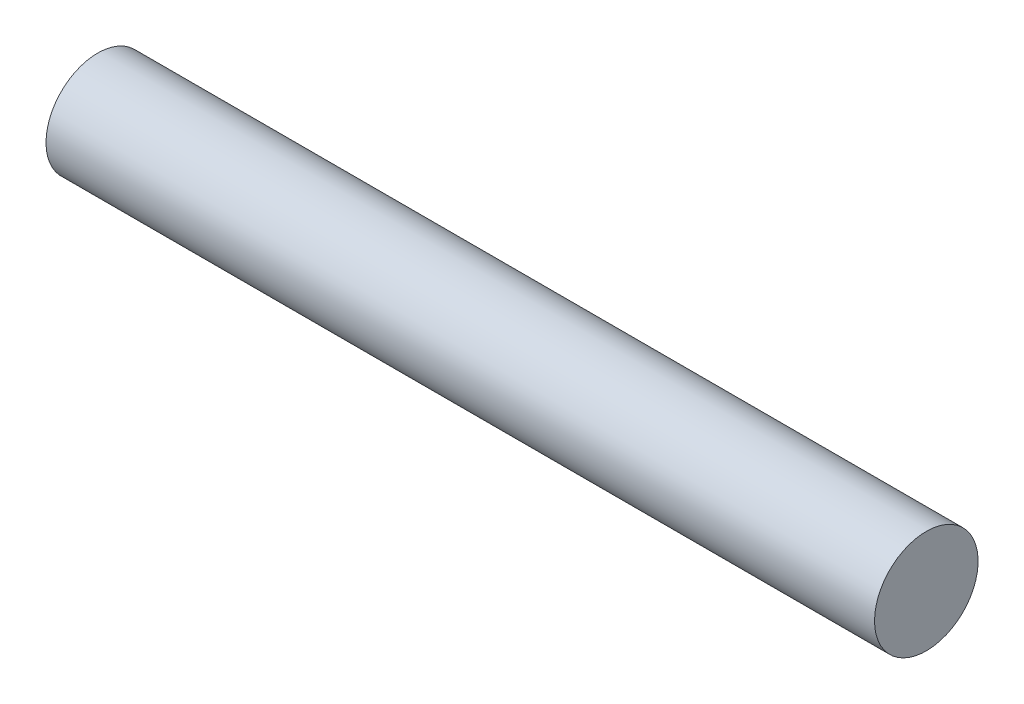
SolidWorks part; units mm, degrees
ref_plane "Front Plane" through (0, 0, 0) normal (0, 0, 1) x (1, 0, 0)
ref_plane "Top Plane" through (0, 0, 0) normal (0, 1, 0) x (1, 0, 0)
ref_plane "Right Plane" through (0, 0, 0) normal (1, 0, 0) x (0, 0, -1)
other "Configuration Table"
sketch "BodySke" plane through (0, 0, 0) normal (0, 0, 1) x (1, 0, 0)
  line L0 (0, 0) -> (93.7991, 0) construction
  line L1 (2, 5) -> (2, 0) construction
  line L2 (0, 0) -> (80, 0)
  line L3 (0, 0) -> (0, 5)
  line L4 (0, 5) -> (80, 5)
  line L5 (80, 0) -> (80, 5)
  line L6 (78.8, 5) -> (78.8, 0) construction
  line L7 (2, 5) -> (0, 4.2721) construction
  line L8 (40, 5) -> (40, 0) construction
  arc A0 (80, 0) -> (78.8, 5) centre (68.9833, 0) ccw construction
  dimension "Diameter" = 10
  dimension "Length" = 80
  dimension "Chamfer_width" = 2
  dimension "Rounded_Height" = 1.2
  dimension "Chamfer_angle" = 20
revolve "BaseBody" add sketch "BodySke" angle 360 about L0
sketch "Double_ChamferSke" plane through (0, 0, 0) normal (0, 0, 1) x (1, 0, 0)
  line L0 (0, 0) -> (17.5895, 0) construction
  line L1 (0, 0) -> (80, 0) construction
  line L2 (2, 5) -> (0, 4.2721) construction
  line L3 (2, 5) -> (0, 4.2721)
  line L4 (0, 4.2721) -> (0, 5)
  line L5 (0, 5) -> (2, 5)
  line L6 (40, 5) -> (40, 0) construction
  line L7 (40, 5) -> (40, 0) construction
  line L8 (80, 5) -> (78, 5)
  line L9 (80, 4.2721) -> (80, 5)
  line L10 (78, 5) -> (80, 4.2721)
revolve "Double_Chamfer" [suppressed] cut sketch "Double_ChamferSke" angle 360 about L0
sketch "Chamfer_RoundedSke" plane through (0, 0, 0) normal (0, 0, 1) x (1, 0, 0)
  line L0 (0, 0) -> (23.2113, 0) construction
  line L1 (0, 0) -> (80, 0) construction
  line L2 (2, 5) -> (0, 4.2721) construction
  line L3 (2, 5) -> (0, 4.2721)
  line L4 (0, 4.2721) -> (0, 5)
  line L5 (0, 5) -> (2, 5)
  line L6 (78.8, 5) -> (80.1, 5)
  line L8 (80.1, 5) -> (80.1, 0)
  line L9 (0, 0) -> (93.7991, 0) construction
  line L10 (80.1, 0) -> (80, 0)
  arc A0 (80, 0) -> (78.8, 5) centre (68.9833, 0) ccw construction
  arc A1 (80, 0) -> (78.8, 5) centre (68.9833, 0) ccw
  dimension "distance" = 0.1
revolve "Chamfer_Rounded" [suppressed] cut sketch "Chamfer_RoundedSke" angle 360 about L0
